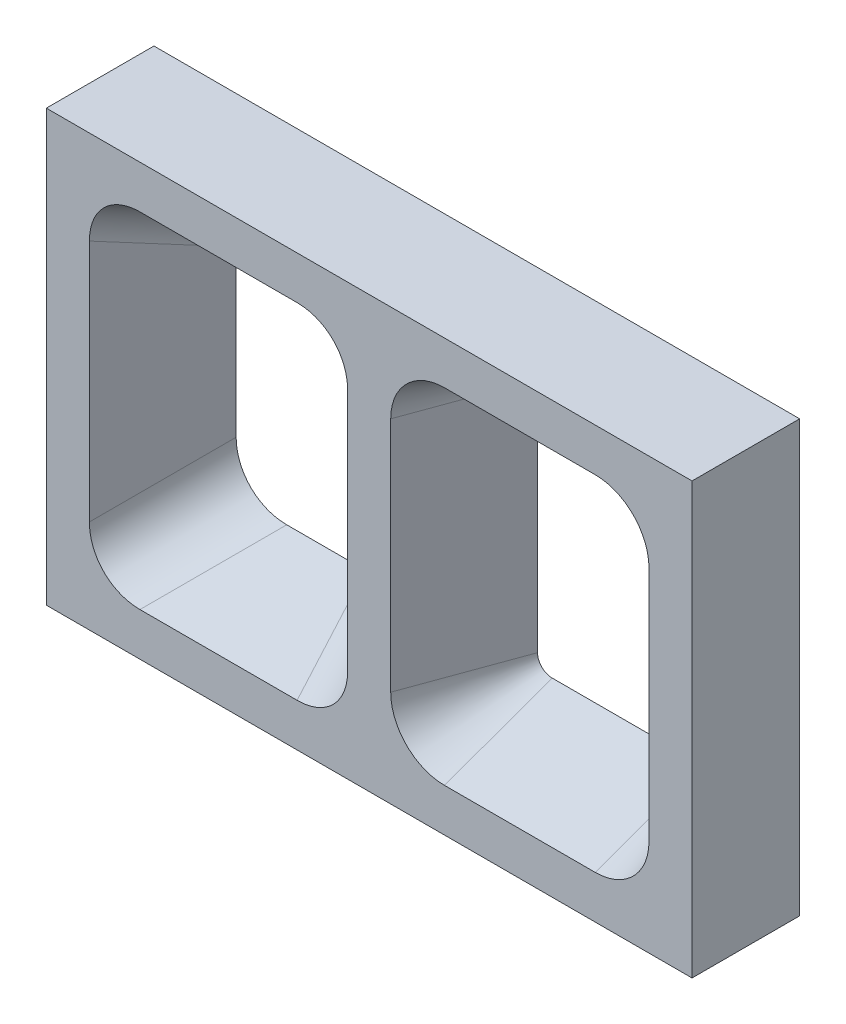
SolidWorks part; units mm, degrees
ref_plane "Front" through (0, 0, 0) normal (0, 0, 1) x (1, 0, 0)
ref_plane "Top" through (0, 0, 0) normal (0, 1, 0) x (1, 0, 0)
ref_plane "Right" through (0, 0, 0) normal (1, 0, 0) x (0, 0, -1)
sketch "Sketch1" plane through (0, 0, 0) normal (0, 0, 1) x (1, 0, 0)
  line L1 (0, 0) -> (76.2, 0)
  line L2 (0, 0) -> (0, 50.8)
  line L3 (0, 50.8) -> (76.2, 50.8)
  line L4 (76.2, 0) -> (76.2, 50.8)
  dimension "D1" = 76.2
  dimension "D2" = 50.8
extrude "Extrude1" add sketch "Sketch1" along normal blind 12.7
sketch "Sketch2" plane through (0, 0, 12.7) normal (0, 0, 1) x (1, 0, 0)
  line L4 (35.56, 45.72) -> (35.56, 5.08)
  line L5 (40.64, 39.37) -> (40.64, 11.43)
  line L6 (46.99, 5.08) -> (64.77, 5.08)
  line L7 (35.56, 45.72) -> (5.08, 45.72)
  line L8 (5.08, 45.72) -> (5.08, 5.08)
  line L9 (5.08, 5.08) -> (71.12, 5.08)
  line L10 (71.12, 5.08) -> (71.12, 45.72)
  line L11 (71.12, 45.72) -> (5.08, 45.72)
  line L12 (5.08, 45.72) -> (5.08, 5.08)
  line L13 (5.08, 5.08) -> (35.56, 5.08)
  line L14 (71.12, 11.43) -> (71.12, 39.37)
  line L15 (64.77, 45.72) -> (46.99, 45.72)
  arc A0 (40.64, 39.37) -> (46.99, 45.72) centre (46.99, 39.37) cw
  arc A1 (40.64, 11.43) -> (46.99, 5.08) centre (46.99, 11.43) ccw
  arc A2 (64.77, 5.08) -> (71.12, 11.43) centre (64.77, 11.43) ccw
  arc A3 (71.12, 39.37) -> (64.77, 45.72) centre (64.77, 39.37) ccw
  point P12 (40.64, 5.08)
  dimension "D4" = 6.35
  dimension "D2" = 30.48
  dimension "D3" = 30.48
  dimension "D1" = 5.08
extrude "Cut-Extrude1" cut sketch "Sketch2" against normal blind 12.7 draft 20
fillet "Fillet1" radius 6.35 4 edges at (7.3912, 7.3912, 6.35) (33.2488, 7.3912, 6.35) (33.2488, 43.4088, 6.35) (7.3912, 43.4088, 6.35)
